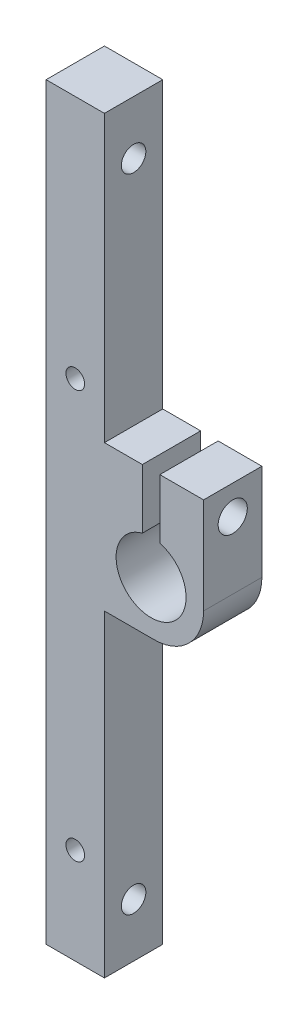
SolidWorks part; units mm, degrees
ref_plane "Спереди" through (0, 0, 0) normal (0, 0, 1) x (1, 0, 0)
ref_plane "Сверху" through (0, 0, 0) normal (0, 1, 0) x (1, 0, 0)
ref_plane "Справа" through (0, 0, 0) normal (1, 0, 0) x (0, 0, -1)
sketch "Эскиз1" plane through (0, 0, 0) normal (0, 0, 1) x (1, 0, 0)
  line L1 (0, 0) -> (10, 0)
  line L2 (0, 0) -> (0, 149)
  line L3 (0, 149) -> (10, 149)
  line L4 (10, 0) -> (10, 149)
  dimension "D1" = 149
  dimension "D2" = 10
extrude "Бобышка-Вытянуть1" add sketch "Эскиз1" along normal blind 10
sketch "Эскиз2" plane through (10, 0, 0) normal (1, 0, 0) x (0, 0, -1)
  line L0 (-10, 0) -> (-10, 149) construction
  line L3 (-10, 0) -> (0, 0) construction
  circle A0 centre (-5, 9.2) radius 2.1
  circle A1 centre (-5, 119.2) radius 2.1
  dimension "D3" = 110
  dimension "D5" = 4.2
  dimension "D6" = 4.2
  dimension "D1" = 5
  dimension "D2" = 5
  dimension "D4" = 9.2
extrude "Вырез-Вытянуть1" cut sketch "Эскиз2" against normal blind 10
sketch "Эскиз3" plane through (0, 0, 10) normal (0, 0, 1) x (1, 0, 0)
  line L0 (10, 0) -> (10, 149) construction
  line L1 (10, 79.5) -> (27, 79.5)
  line L2 (10, 79.5) -> (10, 54.5)
  line L3 (10, 54.5) -> (27, 54.5)
  line L4 (27, 79.5) -> (27, 54.5)
  line L5 (0, 149) -> (0, 0) construction
  point P6 (0, 74.5)
  dimension "D1" = 25
  dimension "D2" = 20
  dimension "D3" = 17
extrude "Бобышка-Вытянуть2" add sketch "Эскиз3" against normal blind 10
sketch "Эскиз4" plane through (0, 0, 10) normal (0, 0, 1) x (1, 0, 0)
  line L0 (10, 0) -> (10, 54.5) construction
  line L1 (10, 54.5) -> (27, 54.5) construction
  circle A0 centre (18, 63.5) radius 6
  dimension "D1" = 12
  dimension "D2" = 8
  dimension "D3" = 9
extrude "Вырез-Вытянуть2" cut sketch "Эскиз4" against normal blind 10
fillet "Скругление1" radius 8.5 1 edges at (27, 54.5, 5)
sketch "Эскиз5" plane through (0, 0, 10) normal (0, 0, 1) x (1, 0, 0)
  line L1 (16.5, 64.4578) -> (19.5, 64.4578)
  line L2 (16.5, 64.4578) -> (16.5, 100.6402)
  line L3 (16.5, 100.6402) -> (19.5, 100.6402)
  line L4 (19.5, 64.4578) -> (19.5, 100.6402)
  circle A0 centre (18, 63.5) radius 6 construction
  dimension "D1" = 1.5
  dimension "D2" = 1.5
extrude "Вырез-Вытянуть3" cut sketch "Эскиз5" against normal through all
sketch "Эскиз6" plane through (27, 0, 0) normal (1, 0, 0) x (0, 0, -1)
  line L0 (0, 54.5) -> (-10, 54.5) construction
  circle A0 centre (-5, 74.5) radius 1.6
  dimension "D1" = 3.2
  dimension "D2" = 20
extrude "Вырез-Вытянуть4" cut sketch "Эскиз6" against normal blind 30
sketch "Эскиз8" plane through (27, 0, 0) normal (1, 0, 0) x (0, 0, -1)
  circle A0 centre (-5, 74.5) radius 2.5
  dimension "D1" = 5
extrude "Вырез-Вытянуть6" cut sketch "Эскиз8" against normal up to surface (7.5 mm away)
sketch "Эскиз9" plane through (0, 0, 10) normal (0, 0, 1) x (1, 0, 0)
  line L0 (0, 0) -> (10, 0) construction
  line L1 (-16.9644, 180.8665) -> (49.3803, 180.8665)
  line L2 (-16.9644, 180.8665) -> (-16.9644, 128.4)
  line L3 (-16.9644, 128.4) -> (49.3803, 128.4)
  line L4 (49.3803, 180.8665) -> (49.3803, 128.4)
  dimension "D1" = 128.4
extrude "Вырез-Вытянуть7" cut sketch "Эскиз9" against normal blind 10
sketch "Эскиз11" plane through (0, 0, 0) normal (0, 0, -1) x (-1, 0, 0)
  line L0 (0, 128.4) -> (0, 0) construction
  line L2 (0, 0) -> (-10, 0) construction
  line L3 (0, 128.4) -> (0, 0) construction
  circle A0 centre (-5, 86.5) radius 1.6
  circle A2 centre (-5, 16.5) radius 1.6
  dimension "D2" = 3.2
  dimension "D3" = 86.5
  dimension "D5" = 70
  dimension "D6" = 3.2
  dimension "D1" = 5
  dimension "D4" = 5
extrude "Вырез-Вытянуть9" cut sketch "Эскиз11" against normal through all
